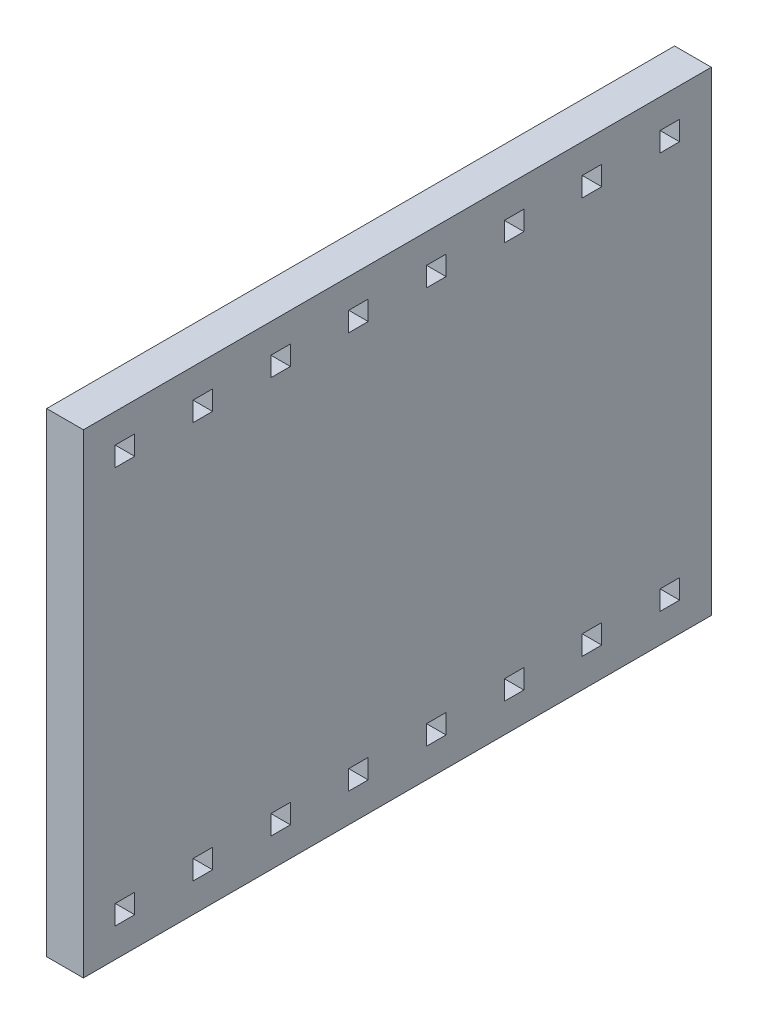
SolidWorks part; units mm, degrees
ref_plane "Alzado" through (0, 0, 0) normal (0, 0, 1) x (1, 0, 0)
ref_plane "Planta" through (0, 0, 0) normal (0, 1, 0) x (1, 0, 0)
ref_plane "Vista lateral" through (0, 0, 0) normal (1, 0, 0) x (0, 0, -1)
sketch "Croquis1" plane through (0, 0, 0) normal (1, 0, 0) x (0, 0, -1)
  line L1 (0, 0) -> (20.5, 0)
  line L2 (0, 0) -> (0, -15.5)
  line L3 (0, -15.5) -> (20.5, -15.5)
  line L4 (20.5, 0) -> (20.5, -15.5)
extrude "Saliente-Extruir1" add sketch "Croquis1" along normal blind 1.2
sketch "Croquis2" plane through (1.2, 0, 0) normal (1, 0, 0) x (0, 0, -1)
  line L0 (10.25, -15.5) -> (10.25, 0) construction
  line L1 (0, -15.5) -> (20.5, -15.5) construction
  line L2 (20.5, 0) -> (0, 0) construction
  line L3 (10.25, -15.5) -> (10.25, -14.5475) construction
  line L4 (11.2025, -14.5475) -> (10.25, -14.5475) construction
  line L5 (11.8385, -13.9115) -> (13.7435, -13.9115) construction
  line L6 (11.8385, -14.5475) -> (13.7435, -14.5475) construction
  line L7 (14.3795, -13.9115) -> (16.2845, -13.9115) construction
  line L8 (13.7435, -13.9115) -> (14.3795, -13.9115)
  line L9 (13.7435, -13.9115) -> (13.7435, -14.5475)
  line L10 (13.7435, -14.5475) -> (14.3795, -14.5475)
  line L11 (14.3795, -13.9115) -> (14.3795, -14.5475)
  line L12 (14.3795, -14.5475) -> (16.2845, -14.5475) construction
  line L13 (16.9205, -13.9115) -> (18.8255, -13.9115) construction
  line L14 (16.2845, -13.9115) -> (16.9205, -13.9115)
  line L15 (16.2845, -13.9115) -> (16.2845, -14.5475)
  line L16 (16.2845, -14.5475) -> (16.9205, -14.5475)
  line L17 (16.9205, -13.9115) -> (16.9205, -14.5475)
  line L18 (16.9205, -14.5475) -> (18.8255, -14.5475) construction
  line L19 (1.6745, -14.5475) -> (1.0385, -14.5475)
  line L20 (18.8255, -13.9115) -> (19.4615, -13.9115)
  line L21 (18.8255, -13.9115) -> (18.8255, -14.5475)
  line L22 (18.8255, -14.5475) -> (19.4615, -14.5475)
  line L23 (19.4615, -13.9115) -> (19.4615, -14.5475)
  line L24 (1.0385, -13.9115) -> (1.0385, -14.5475)
  line L25 (1.6745, -13.9115) -> (1.6745, -14.5475)
  line L26 (1.6745, -13.9115) -> (1.0385, -13.9115)
  line L27 (11.2025, -13.9115) -> (11.2025, -14.5475)
  line L28 (11.2025, -14.5475) -> (11.8385, -14.5475)
  line L29 (11.2025, -13.9115) -> (11.8385, -13.9115)
  line L30 (11.8385, -13.9115) -> (11.8385, -14.5475)
  line L31 (4.2155, -14.5475) -> (3.5795, -14.5475)
  line L32 (3.5795, -13.9115) -> (3.5795, -14.5475)
  line L33 (4.2155, -13.9115) -> (3.5795, -13.9115)
  line L34 (4.2155, -13.9115) -> (4.2155, -14.5475)
  line L35 (6.7565, -14.5475) -> (6.1205, -14.5475)
  line L36 (6.1205, -13.9115) -> (6.1205, -14.5475)
  line L37 (6.7565, -13.9115) -> (6.1205, -13.9115)
  line L38 (6.7565, -13.9115) -> (6.7565, -14.5475)
  line L39 (8.6615, -13.9115) -> (8.6615, -14.5475)
  line L40 (9.2975, -14.5475) -> (8.6615, -14.5475)
  line L41 (9.2975, -13.9115) -> (9.2975, -14.5475)
  line L42 (9.2975, -13.9115) -> (8.6615, -13.9115)
  line L43 (0, -7.75) -> (20.5, -7.75) construction
  line L44 (0, 0) -> (0, -15.5) construction
  line L45 (20.5, -15.5) -> (20.5, 0) construction
  line L46 (16.9205, -0.9525) -> (18.8255, -0.9525) construction
  line L47 (16.9205, -1.5885) -> (18.8255, -1.5885) construction
  line L48 (14.3795, -0.9525) -> (16.2845, -0.9525) construction
  line L49 (14.3795, -1.5885) -> (16.2845, -1.5885) construction
  line L50 (11.8385, -0.9525) -> (13.7435, -0.9525) construction
  line L51 (11.8385, -1.5885) -> (13.7435, -1.5885) construction
  line L52 (11.2025, -0.9525) -> (10.25, -0.9525) construction
  line L53 (9.2975, -1.5885) -> (8.6615, -1.5885)
  line L54 (9.2975, -1.5885) -> (9.2975, -0.9525)
  line L55 (9.2975, -0.9525) -> (8.6615, -0.9525)
  line L56 (8.6615, -1.5885) -> (8.6615, -0.9525)
  line L57 (6.7565, -1.5885) -> (6.7565, -0.9525)
  line L58 (6.7565, -1.5885) -> (6.1205, -1.5885)
  line L59 (6.1205, -1.5885) -> (6.1205, -0.9525)
  line L60 (6.7565, -0.9525) -> (6.1205, -0.9525)
  line L61 (4.2155, -1.5885) -> (4.2155, -0.9525)
  line L62 (4.2155, -1.5885) -> (3.5795, -1.5885)
  line L63 (3.5795, -1.5885) -> (3.5795, -0.9525)
  line L64 (4.2155, -0.9525) -> (3.5795, -0.9525)
  line L65 (11.8385, -1.5885) -> (11.8385, -0.9525)
  line L66 (11.2025, -1.5885) -> (11.8385, -1.5885)
  line L67 (11.2025, -0.9525) -> (11.8385, -0.9525)
  line L68 (11.2025, -1.5885) -> (11.2025, -0.9525)
  line L69 (1.6745, -1.5885) -> (1.0385, -1.5885)
  line L70 (1.6745, -1.5885) -> (1.6745, -0.9525)
  line L71 (1.0385, -1.5885) -> (1.0385, -0.9525)
  line L72 (19.4615, -1.5885) -> (19.4615, -0.9525)
  line L73 (18.8255, -0.9525) -> (19.4615, -0.9525)
  line L74 (18.8255, -1.5885) -> (18.8255, -0.9525)
  line L75 (18.8255, -1.5885) -> (19.4615, -1.5885)
  line L76 (1.6745, -0.9525) -> (1.0385, -0.9525)
  line L77 (16.9205, -1.5885) -> (16.9205, -0.9525)
  line L78 (16.2845, -0.9525) -> (16.9205, -0.9525)
  line L79 (16.2845, -1.5885) -> (16.2845, -0.9525)
  line L80 (16.2845, -1.5885) -> (16.9205, -1.5885)
  line L81 (14.3795, -1.5885) -> (14.3795, -0.9525)
  line L82 (13.7435, -0.9525) -> (14.3795, -0.9525)
  line L83 (13.7435, -1.5885) -> (13.7435, -0.9525)
  line L84 (13.7435, -1.5885) -> (14.3795, -1.5885)
  dimension "D1" = 1.905
  dimension "D2" = 0.9525
  dimension "D3" = 0.636
  dimension "D4" = 0.636
  dimension "D5" = 0.636
  dimension "D6" = 1.905
  dimension "D7" = 0.636
  dimension "D8" = 1.905
  dimension "D9" = 0.636
  dimension "D10" = 0.636
extrude "Cortar-Extruir1" cut sketch "Croquis2" against normal blind 1.2
